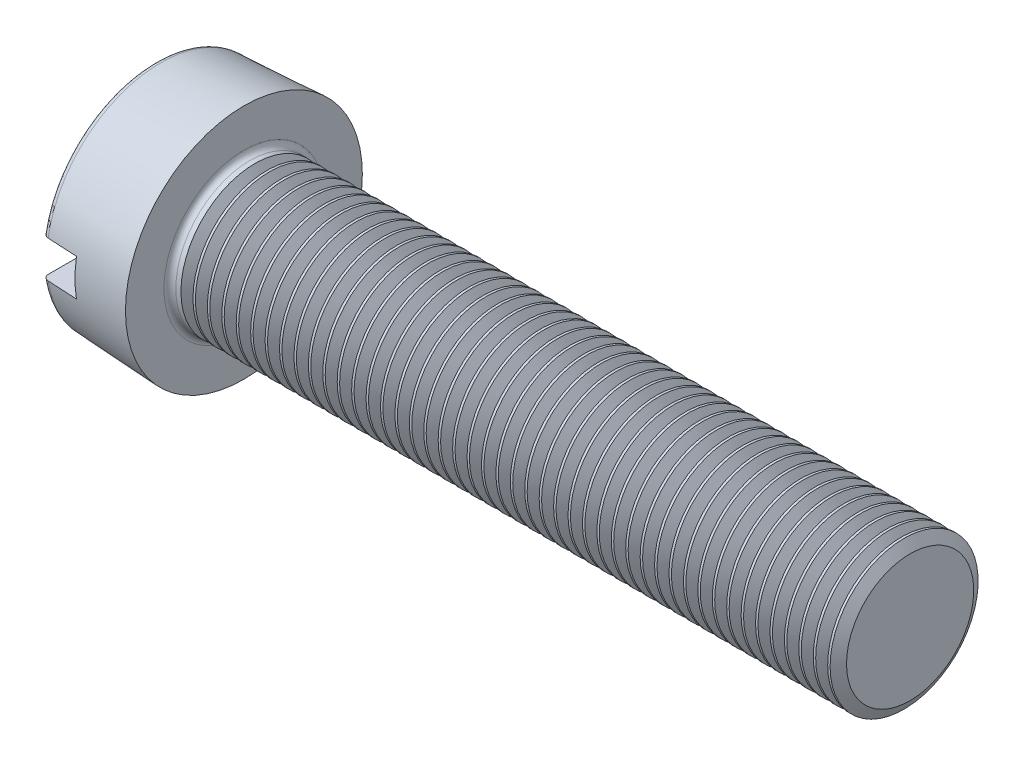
SolidWorks part; units mm, degrees
ref_plane "Front" through (0, 0, 0) normal (0, 0, 1) x (1, 0, 0)
ref_plane "Top" through (0, 0, 0) normal (0, 1, 0) x (1, 0, 0)
ref_plane "Right" through (0, 0, 0) normal (1, 0, 0) x (0, 0, -1)
other "Configuration Table"
ref_plane "Plane1" through (6, 0, 0) normal (1, 0, 0) x (0, 0, -1)
sketch "Sketch2" plane through (6, 0, 0) normal (1, 0, 0) x (0, 0, -1)
  circle A0 centre (0, 0) radius 8
  dimension "dk" = 16
extrude "BaseHead" add sketch "Sketch2" against normal blind 6 draft 3
sketch "Sketch3" plane through (6, -1.1101, -1.3544) normal (1, 0, 0) x (0, 0, -1)
  line L0 (-1.3544, 1.1101) -> (1.6456, 1.1101) construction
  circle A0 centre (-1.3544, 1.1101) radius 5
  circle A1 centre (-1.3544, 1.1101) radius 8 construction
extrude "BaseBody" add sketch "Sketch3" along normal blind 45
sketch "Sketch4" plane through (-1.9, -1.9, 0) normal (0, 0, 1) x (0, 1, 0)
  line L1 (0.65, -1.9) -> (3.15, -1.9)
  line L2 (0.65, -1.9) -> (0.65, -4.3)
  line L3 (0.65, -4.3) -> (3.15, -4.3)
  line L4 (3.15, -1.9) -> (3.15, -4.3)
  line L5 (9.5856, -1.9) -> (-5.7856, -1.9) construction
extrude "Slot" cut sketch "Sketch4" against normal through all and the other way through all
fillet "HeadFillet" radius 0.4 3 edges at (6, 0, -5) (0, -7.6856, 0) (0, 7.6856, 0)
sketch "Sketch1" plane through (0, 0, 0) normal (0, 0, 1) x (1, 0, 0)
  line L0 (5.5483, 0) -> (-2.9147, 0) construction
  line L1 (6, 9.188) -> (13, 9.188)
  line L2 (6, 9.188) -> (6, 4.188)
  line L3 (6, 4.188) -> (9.2, 4.188)
  line L8 (13, 5) -> (9.2, 4.188)
  line L9 (13, 9.188) -> (13, 5)
  line L10 (6, -8) -> (6, 8) construction
  line L11 (51, -5) -> (51, 5) construction
  line L12 (51, 5) -> (6.4, 5) construction
  dimension "b1" = 8.376
  dimension "b" = 38
  dimension "x" = 3.8
  dimension "dd" = 5
sketch "Sketch5" plane through (0, 0, 0) normal (0, 0, 1) x (1, 0, 0)
  line L0 (51.406, 5) -> (51.406, 5.812)
  line L1 (51.406, 5.812) -> (50.594, 5.812)
  line L2 (50.594, 5.812) -> (50.594, 5)
  line L3 (50.594, 5) -> (51, 4.2968)
  line L4 (51, 4.2968) -> (51.406, 5)
  line L5 (51, -5) -> (51, 5) construction
  line L6 (0, 0) -> (15.9087, 0) construction
revolve "Cut-Revolve10" cut sketch "Sketch5" angle 360 about L6
pattern_linear "LPattern10" count 46 spacing 0.9744 along (-1, 0, 0) of "Cut-Revolve10"
equation "\"m@Sketch4\" = \"n@Sketch4\" / 2"
equation "\"D1@Plane1\"=\"k@BaseHead\""
equation "\"D1@Sketch5\" = \"d@Sketch3\""
equation "\"D2@Sketch5\" =  ( \"d@Sketch3\" - \"D2@ThreadCosmetic1\" )  / 2"
equation "\"D3@LPattern10\" = \"D2@Sketch5\" * 1.2"
equation "\"D1@LPattern10\" = \"D1@ThreadCosmetic1\" / \"D3@LPattern10\""
